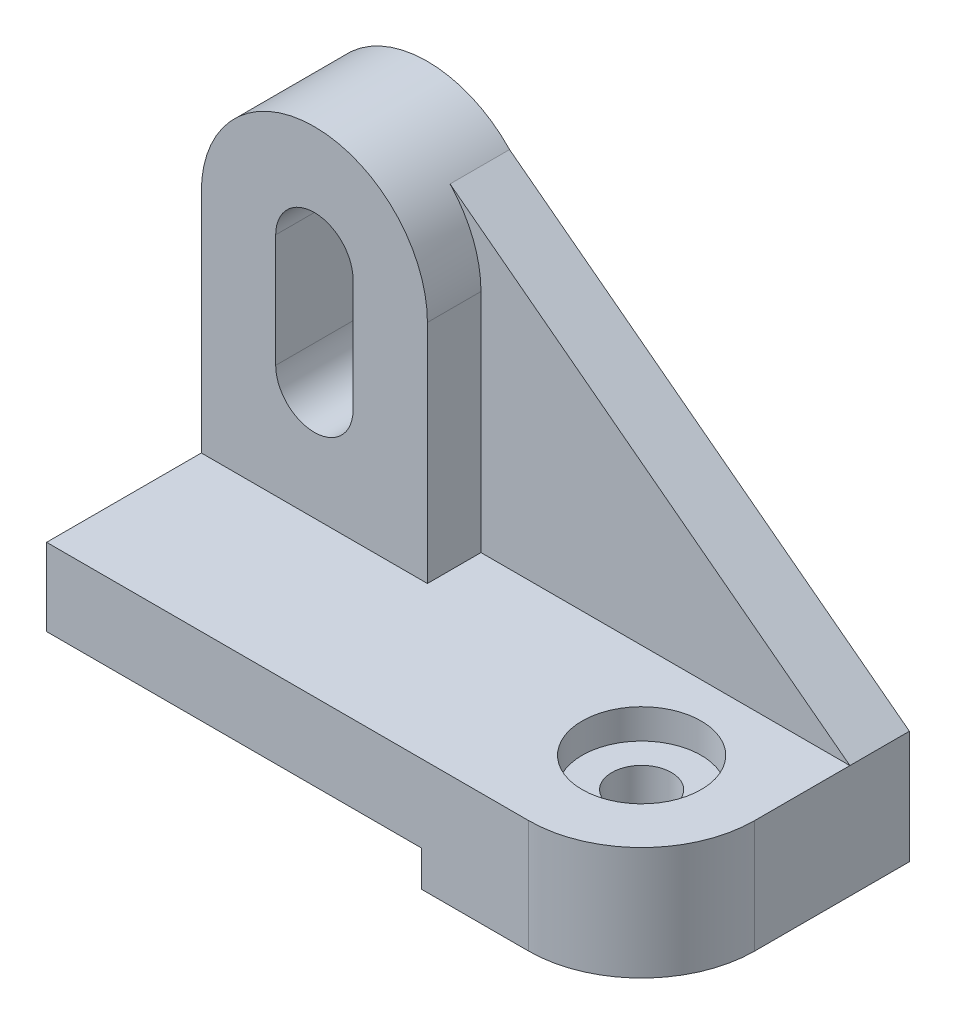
SolidWorks part; units mm, degrees
ref_plane "Front Plane" through (0, 0, 0) normal (0, 0, 1) x (1, 0, 0)
ref_plane "Top Plane" through (0, 0, 0) normal (0, 1, 0) x (1, 0, 0)
ref_plane "Right Plane" through (0, 0, 0) normal (1, 0, 0) x (0, 0, -1)
sketch "Sketch1" plane through (0, 0, 0) normal (0, 0, 1) x (1, 0, 0)
  line L0 (0, 0) -> (0, 130)
  line L1 (0, 130) -> (1000, 130)
  line L2 (1000, 130) -> (1000, -60)
  line L3 (1000, -60) -> (630, -60)
  line L4 (630, -60) -> (630, 0)
  line L5 (630, 0) -> (0, 0)
  point P5 (0, 0)
  dimension "D1" = 130
  dimension "D2" = 60
  dimension "D3" = 1000
  dimension "D4" = 630
  dimension "D5" = 190
extrude "Boss-Extrude1" add sketch "Sketch1" along normal blind 450
fillet "Fillet2" radius 190 1 edges at (1000, 35, 450)
sketch "Sketch2" plane through (0, 130, 0) normal (0, 1, 0) x (1, 0, 0)
  circle A0 centre (810, -260) radius 100
  point P3 (0, 0)
  dimension "D1" = 200
extrude "Cut-Extrude2" cut sketch "Sketch2" against normal blind 50 contours A0
sketch "Sketch6" plane through (0, 80, 0) normal (0, 1, 0) x (1, 0, 0)
  circle A0 centre (810, -260) radius 50
  dimension "D1" = 100
extrude "Cut-Extrude4" cut sketch "Sketch6" against normal blind 506 and the other way blind 309
sketch "Sketch8" plane through (0, 0, 0) normal (0, 0, -1) x (-1, 0, 0)
  line L0 (0, 130) -> (0, 510)
  line L1 (-380, 130) -> (-380, 510)
  line L2 (-1000, 130) -> (0, 130) construction
  line L3 (-1000, 130) -> (-336.5857, 630.8827)
  line L4 (-190, 510) -> (-190, 320) construction
  line L5 (-125, 510) -> (-125, 320)
  line L6 (-255, 510) -> (-255, 320)
  arc A0 (0, 510) -> (-380, 510) centre (-190, 510) ccw
  arc A1 (-125, 510) -> (-255, 510) centre (-190, 510) ccw
  arc A2 (-255, 320) -> (-125, 320) centre (-190, 320) ccw
  point P12 (-190, 415)
  point P18 (0, 0)
  dimension "D1" = 190
  dimension "D3" = 65
  dimension "D2" = 570
  dimension "D4" = 190
extrude "Boss-Extrude2" add sketch "Sketch8" against normal blind 190 contours L0 A0 L1 A2 L6 A1 L5 M10
sketch "Sketch10" plane through (0, 0, 0) normal (0, 0, -1) x (-1, 0, 0)
  line L0 (-1000, 130) -> (-328.0365, 640.56)
  arc A0 (0, 510) -> (-380, 510) centre (-190, 510) ccw construction
rib "Rib9" sketch "Sketch10" sketch "Sketch10" thickness 100 extrusion direction parallel to sketch draft on no parameters "D1"=100
